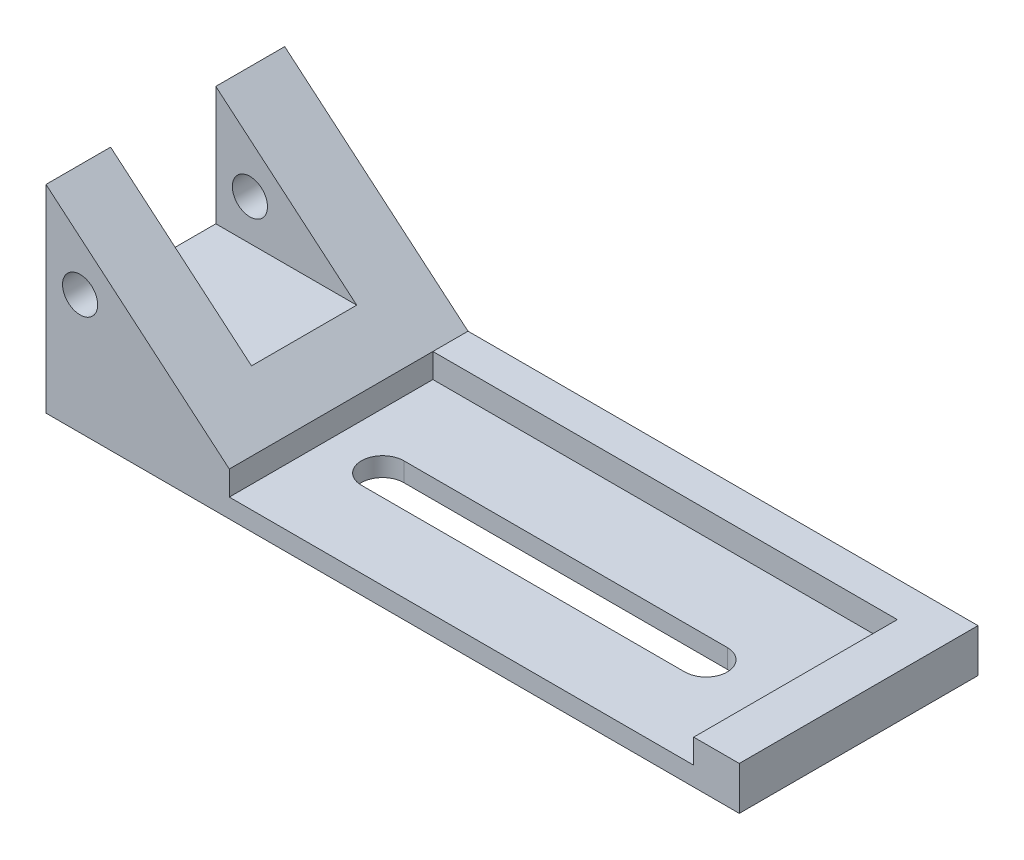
SolidWorks part; units mm, degrees
ref_plane "Front Plane" through (0, 0, 0) normal (0, 0, 1) x (1, 0, 0)
ref_plane "Top Plane" through (0, 0, 0) normal (0, 1, 0) x (1, 0, 0)
ref_plane "Right Plane" through (0, 0, 0) normal (1, 0, 0) x (0, 0, -1)
sketch "Sketch1"
extrude "Extrude1" add sketch "Sketch1" along normal blind 18.542
sketch "Sketch2"
extrude "Extrude2" add sketch "Sketch2" against normal up to surface (102.2706 mm away)
sketch "Sketch3"
extrude "Cut-Extrude1" cut sketch "Sketch3" against normal through all
sketch "Sketch4"
extrude "Cut-Extrude2" cut sketch "Sketch4" against normal blind 10.414
sketch "Sketch5"
extrude "Cut-Extrude3" cut sketch "Sketch5" against normal through all
sketch "Sketch6"
extrude "Cut-Extrude4" cut sketch "Sketch6" against normal through all
